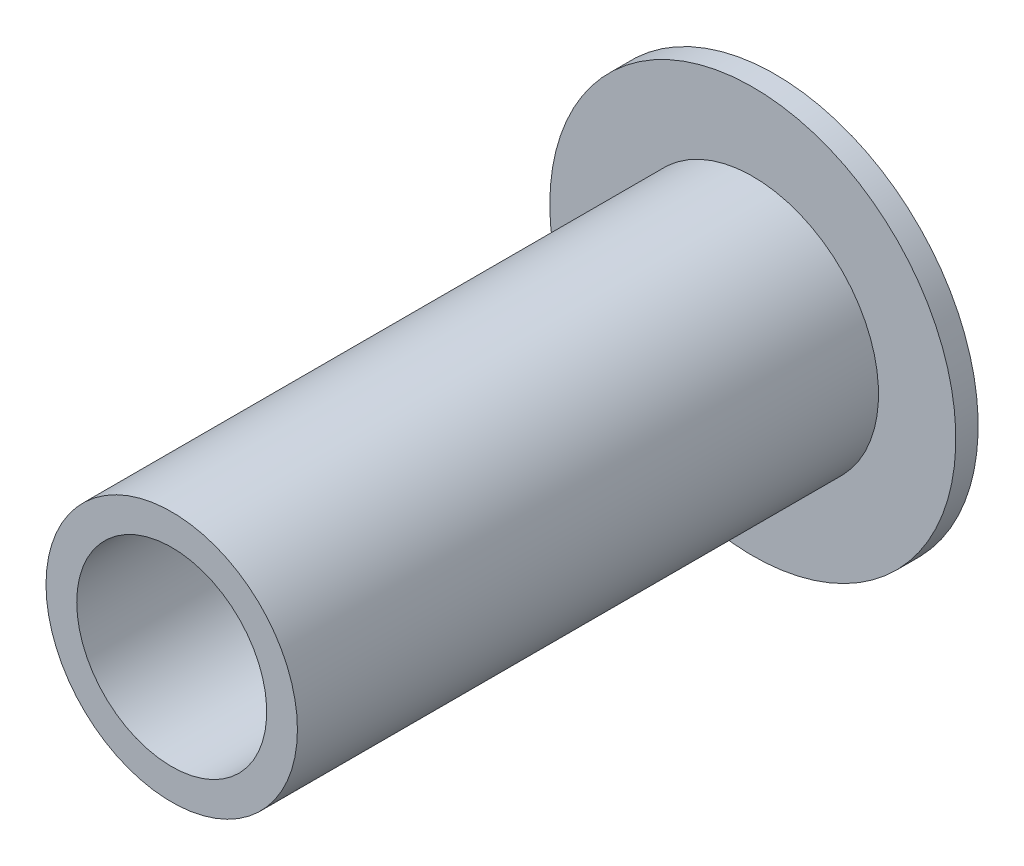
SolidWorks part; units mm, degrees
ref_plane "Plan1" through (0, 0, 0) normal (0, 0, 1) x (1, 0, 0)
ref_plane "Plan2" through (0, 0, 0) normal (0, 1, 0) x (1, 0, 0)
ref_plane "Plan3" through (0, 0, 0) normal (1, 0, 0) x (0, 0, -1)
sketch "Esquisse1" plane through (0, 0, 0) normal (0, 0, 1) x (1, 0, 0)
  circle A0 centre (0, 0) radius 3.375
  dimension "D1" = 6.75
extrude "Base-Extrusion" add sketch "Esquisse1" along normal blind 15.6
sketch "Esquisse2" plane through (0, 0, 0) normal (0, 0, -1) x (-1, 0, 0)
  circle A0 centre (0, 0) radius 5.45
  dimension "D1" = 10.9
extrude "Boss.-Extru.1" add sketch "Esquisse2" along normal blind 0.6
sketch "Esquisse3" plane through (0, 0, -0.6) normal (0, 0, -1) x (-1, 0, 0)
  circle A0 centre (0, 0) radius 3.5
  dimension "D1" = 7
extrude "Boss.-Extru.2" add sketch "Esquisse3" along normal blind 1
sketch "Esquisse4" plane through (0, 0, -1.6) normal (0, 0, -1) x (-1, 0, 0)
  circle A0 centre (0, 0) radius 2.55
  dimension "D1" = 5.1
extrude "Enlèv. mat.-Extru.1" cut sketch "Esquisse4" against normal through all
chamfer "Chanfrein1" distance 0.6 angle 45
